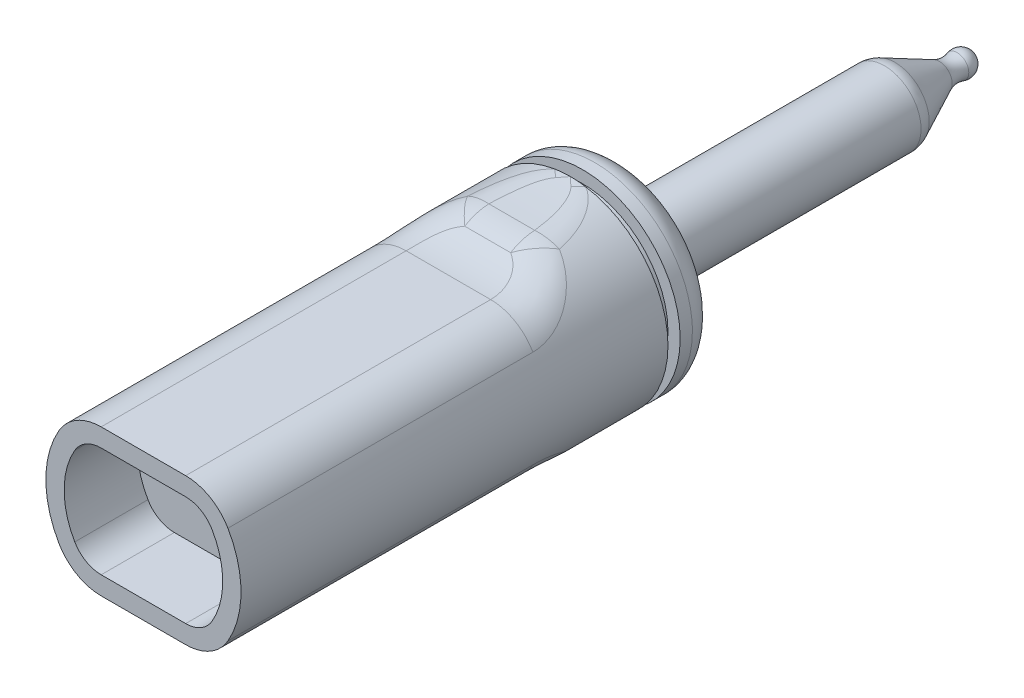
SolidWorks part; units mm, degrees
ref_plane "Front Plane" through (0, 0, 0) normal (0, 0, 1) x (1, 0, 0)
ref_plane "Top Plane" through (0, 0, 0) normal (0, 1, 0) x (1, 0, 0)
ref_plane "Right Plane" through (0, 0, 0) normal (1, 0, 0) x (0, 0, -1)
sketch "Sketch1" plane through (0, 0, 0) normal (0, 1, 0) x (1, 0, 0)
  line L0 (0, 0) -> (0, 45) construction
  line L2 (4, 0) -> (4, 17.5)
  line L3 (4, 20) -> (0, 20)
  line L5 (4, 18) -> (3.5, 18)
  line L6 (3.5, 18) -> (3.5, 17.5)
  line L7 (3.5, 17.5) -> (4, 17.5)
  line L8 (4, 18) -> (4, 20)
  line L9 (4, 0) -> (0, 0)
  line L10 (0, 0) -> (0, 20)
  point P12 (4, 20)
  dimension "D1" = 45
  dimension "D2" = 4
  dimension "D3" = 20
  dimension "D4" = 0.5
  dimension "D5" = 0.5
  dimension "D6" = 2
revolve "Revolve1" add sketch "Sketch1" angle 360 about L0
sketch "Sketch2" plane through (0, 0, 0) normal (1, 0, 0) x (0, 0, -1)
  line L0 (0, 3) -> (12.5, 3)
  line L1 (0, 4) -> (0, -4) construction
  line L2 (17.5, 4) -> (0, 4) construction
  line L3 (17.5, -4) -> (17.5, 4) construction
  line L4 (0, 3) -> (0, 4)
  line L6 (0, 4) -> (17.5, 4)
  arc A0 (12.5, 3) -> (14.5, 3.75) centre (12.5, 6.0417) ccw
  spline S0 degree 2 poles (14.5, 3.75) (16.1263, 3.7682) (17.5, 4) knots 0 0 0 1 1 1
  dimension "D1" = 2
  dimension "D4" = 0.25
  dimension "D2" = 1
  dimension "D3" = 3
extrude "Cut-Extrude1" cut sketch "Sketch2" against normal through all both and the other way through all
mirror "Mirror1" about plane through (0, 0, 0) normal (0, 1, 0) of "Cut-Extrude1"
fillet "Fillet1" radius 2 14 edges at (-2.6458, -3, -6.25) (2.6458, -3, -6.25) (2.6458, 3, -6.25) (-2.6458, 3, -6.25) (-2.4099, -3.1926, -13.5651) (2.2878, -3.2812, -13.7773) (-2.4099, 3.1926, -13.5651) (2.2878, 3.2812, -13.7773) (-0.5926, -3.9559, -17.2233) (0.708, -3.9369, -17.0934) (0, -3.75, -14.5) (0, 3.75, -14.5) (0.708, 3.9369, -17.0934) (-0.5926, 3.9559, -17.2233)
fillet "Fillet2" radius 2.5 1 edges at (4, 0, -20)
sketch "Sketch3" plane through (0, 0, 0) normal (0, 0, 1) x (1, 0, 0)
  line L4 (-1.7321, -2.25) -> (1.7321, -2.25)
  line L5 (1.7321, 2.25) -> (-1.7321, 2.25)
  line L6 (-1.7321, -2.25) -> (1.7321, -2.25)
  line L7 (1.7321, 2.25) -> (-1.7321, 2.25)
  arc A12 (1.7321, -2.25) -> (2.8146, -1.625) centre (1.7321, -1) ccw
  arc A13 (2.8146, -1.625) -> (2.8146, 1.625) centre (0, 0) ccw
  arc A14 (2.8146, 1.625) -> (1.7321, 2.25) centre (1.7321, 1) ccw
  arc A15 (-1.7321, 2.25) -> (-2.8146, 1.625) centre (-1.7321, 1) ccw
  arc A16 (-2.8146, 1.625) -> (-2.8146, -1.625) centre (0, 0) ccw
  arc A17 (-2.8146, -1.625) -> (-1.7321, -2.25) centre (-1.7321, -1) ccw
  arc A18 (1.7321, -2.25) -> (2.8146, -1.625) centre (1.7321, -1) ccw
  arc A19 (2.8146, -1.625) -> (2.8146, 1.625) centre (0, 0) ccw
  arc A20 (2.8146, 1.625) -> (1.7321, 2.25) centre (1.7321, 1) ccw
  arc A21 (-1.7321, 2.25) -> (-2.8146, 1.625) centre (-1.7321, 1) ccw
  arc A22 (-2.8146, 1.625) -> (-2.8146, -1.625) centre (0, 0) ccw
  arc A23 (-2.8146, -1.625) -> (-1.7321, -2.25) centre (-1.7321, -1) ccw
  dimension "D1" = 0.75
extrude "Cut-Extrude2" cut sketch "Sketch3" against normal blind 3
sketch "Sketch6" plane through (0, 0, 0) normal (0, 1, 0) x (1, 0, 0)
  line L0 (0, 20) -> (0, 34)
  line L1 (0, 0) -> (0, 45) construction
  line L2 (0.3, 33.1) -> (1.5, 30.6)
  line L3 (1.5, 30.6) -> (1.5, 19)
  line L4 (1.5, 19) -> (0, 19)
  line L5 (0, 0) -> (0, 20) construction
  line L6 (0, 19) -> (0, 20)
  arc A0 (0, 34) -> (0.3, 33.1) centre (0, 33.5) cw
  dimension "D2" = 0.5
  dimension "D1" = 14
  dimension "D3" = 0.9
  dimension "D4" = 1.5
  dimension "D5" = 1
  dimension "D6" = 2.5
revolve "Revolve2" add sketch "Sketch6" angle 360 about L0
fillet "Fillet3" radius 1 1 edges at (1.5, 0, -30.6)
fillet "Fillet4" radius 1 1 edges at (0.3, 0, -33.1)
shell "Shell1" thickness 0.2
